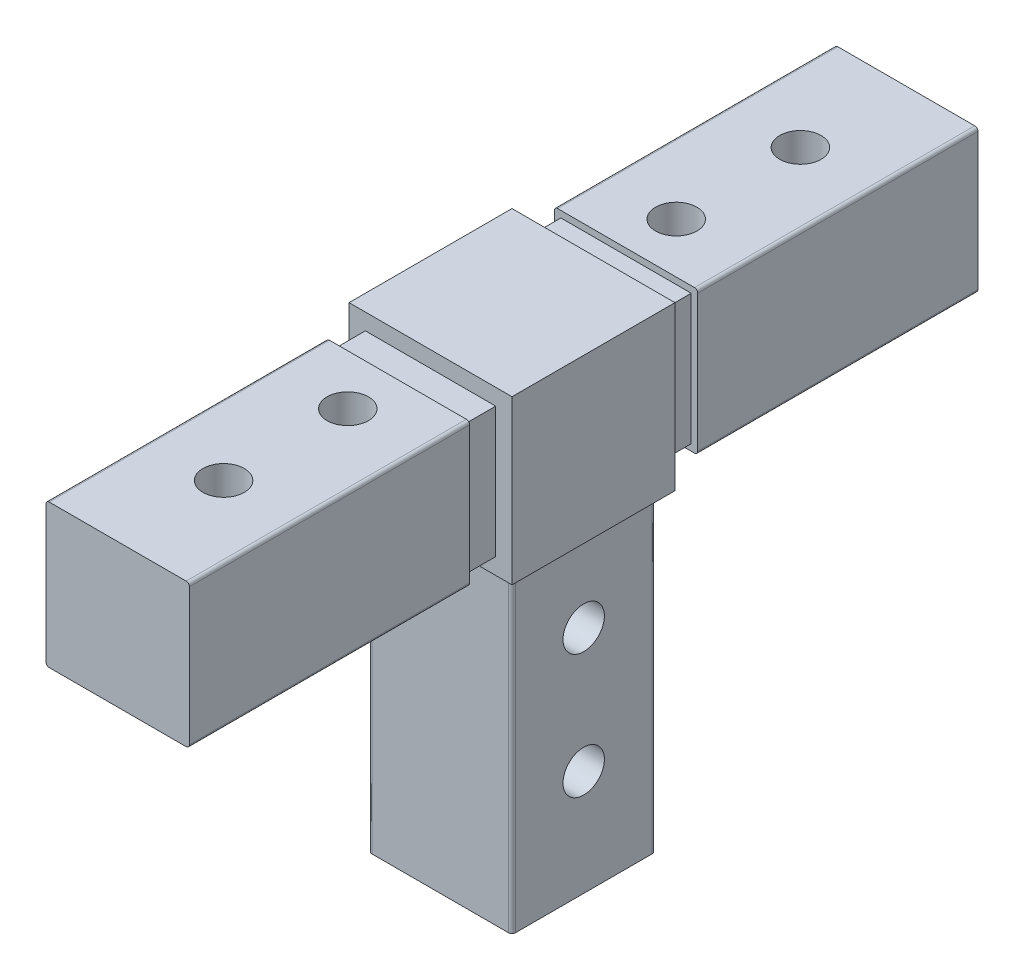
SolidWorks part; units mm, degrees
ref_plane "Front Plane" through (0, 0, 0) normal (0, 0, 1) x (1, 0, 0)
ref_plane "Top Plane" through (0, 0, 0) normal (0, 1, 0) x (1, 0, 0)
ref_plane "Right Plane" through (0, 0, 0) normal (1, 0, 0) x (0, 0, -1)
imported_body "Imported2"
imported_body "Imported3"
sketch "Sketch1" plane through (0, 0, 12.5) normal (0, 0, 1) x (1, 0, 0)
  line L0 (-10, 10) -> (10, 10)
  line L1 (10, 10) -> (10, -10)
  line L2 (10, -10) -> (-10, -10)
  line L3 (-10, -10) -> (-10, 10)
extrude "Boss-Extrude1" add sketch "Sketch1" along normal blind 5
ref_plane "Plane1" through (0, 0, 17.5) normal (0, 0, -1) x (-1, 0, 0)
sketch "Sketch2" plane through (0, 0, 17.5) normal (0, 0, -1) x (-1, 0, 0)
  line L0 (11, -11) -> (11, 11)
  line L1 (11, 11) -> (-11, 11)
  line L2 (-11, 11) -> (-11, -11)
  line L3 (-11, -11) -> (11, -11)
extrude "Boss-Extrude2" add sketch "Sketch2" against normal blind 43
sketch "Sketch3" plane through (0, 10, 0) normal (0, 1, 0) x (-1, 0, 0)
  line L0 (12.5, -12.5) -> (-12.5, -12.5)
  line L1 (-12.5, -12.5) -> (-12.5, 12.5)
  line L2 (-12.5, 12.5) -> (12.5, 12.5)
  line L3 (12.5, 12.5) -> (12.5, -12.5)
extrude "Boss-Extrude3" add sketch "Sketch3" along normal blind 2.5
sketch "Sketch4" plane through (0, -10, 0) normal (0, -1, 0) x (1, 0, 0)
  line L0 (12.5, -12.5) -> (-12.5, -12.5)
  line L1 (-12.5, -12.5) -> (-12.5, 12.5)
  line L2 (-12.5, 12.5) -> (12.5, 12.5)
  line L3 (12.5, 12.5) -> (12.5, -12.5)
extrude "Boss-Extrude4" add sketch "Sketch4" along normal blind 2.5
sketch "Sketch5" plane through (0, 0, -12.5) normal (0, 0, -1) x (-1, 0, 0)
  line L0 (10, -11) -> (-11, -11)
  line L1 (-11, -11) -> (-11, 11)
  line L2 (-11, 11) -> (10, 11)
  line L3 (10, 11) -> (10, -11)
extrude "Boss-Extrude5" add sketch "Sketch5" along normal blind 48
ref_plane "Plane2" through (0, 0, -12.5) normal (0, 0, 1) x (1, 0, 0)
sketch "Sketch6" plane through (0, 0, -12.5) normal (0, 0, 1) x (1, 0, 0)
  line L0 (-10, -10) -> (-10, -11)
  line L1 (-10, -11) -> (11, -11)
  line L2 (11, -11) -> (11, 11)
  line L3 (11, 11) -> (-10, 11)
  line L4 (-10, 11) -> (-10, 10)
  line L5 (-10, 10) -> (10, 10)
  line L6 (10, 10) -> (10, -10)
  line L7 (10, -10) -> (-10, -10)
extrude "Cut-Extrude1" cut sketch "Sketch6" against normal blind 5
sketch "Sketch7" plane through (-10, 0, 0) normal (-1, 0, 0) x (0, 0, 1)
  line L0 (-17.5, 11) -> (-17.5, -11)
  line L1 (-17.5, -11) -> (-60.5, -11)
  line L2 (-60.5, -11) -> (-60.5, 11)
  line L3 (-60.5, 11) -> (-17.5, 11)
extrude "Boss-Extrude6" add sketch "Sketch7" along normal blind 1
sketch "Sketch8" plane through (0, -12.5, 0) normal (0, -1, 0) x (1, 0, 0)
  line L0 (-11, 11) -> (11, 11)
  line L1 (11, 11) -> (11, -11)
  line L2 (11, -11) -> (-11, -11)
  line L3 (-11, -11) -> (-11, 11)
extrude "Boss-Extrude7" add sketch "Sketch8" along normal blind 48
fillet "Fillet1" radius 0.5 12 edges at (-11, -11, -39) (-11, -36.5, -11) (11, -36.5, 11) (11, -11, 39) (11, -11, -39) (11, 11, 39) (-11, -36.5, 11) (-11, 11, 39) (11, -36.5, -11) (-11, 11, -39) (-11, -11, 39) (11, 11, -39)
sketch "Sketch9" plane through (0, 11, 0) normal (0, 1, 0) x (1, 0, 0)
  line L0 (0, -60.5) -> (0, -17.5) construction
  line L1 (-10.5, -60.5) -> (10.5, -60.5) construction
  line L2 (-10.5, -17.5) -> (10.5, -17.5) construction
  line L3 (0, 17.5) -> (0, 60.5) construction
  line L4 (10.5, 17.5) -> (-10.5, 17.5) construction
  line L5 (-10.5, 60.5) -> (10.5, 60.5) construction
  line L6 (-12.5, -12.5) -> (12.5, -12.5) construction
  line L7 (-10, -12.5) -> (10, -12.5) construction
  line L8 (-13.75, 12.5) -> (13.75, 12.5) construction
  circle A0 centre (0, -25.2) radius 3.175
  circle A1 centre (0, -44.25) radius 3.175
  circle A2 centre (0, 25.2) radius 3.175
  circle A3 centre (0, 44.25) radius 3.175
  dimension "D3" = 6.35
  dimension "D4" = 6.35
  dimension "D7" = 6.35
  dimension "D8" = 6.35
  dimension "D1" = 12.7
  dimension "D2" = 31.75
  dimension "D5" = 12.7
  dimension "D6" = 31.75
extrude "Cut-Extrude2" cut sketch "Sketch9" against normal up to surface (22 mm away)
sketch "Sketch10" plane through (11, 0, 0) normal (1, 0, 0) x (0, 0, -1)
  line L0 (0, -12.5) -> (0, -60.5) construction
  line L1 (10.5, -12.5) -> (-10.5, -12.5) construction
  line L2 (10.5, -60.5) -> (-10.5, -60.5) construction
  line L3 (12.5, -12.5) -> (-12.5, -12.5) construction
  circle A0 centre (0, -25.2) radius 3.175
  circle A1 centre (0, -44.25) radius 3.175
  dimension "D3" = 6.35
  dimension "D4" = 6.35
  dimension "D1" = 12.7
  dimension "D2" = 31.75
extrude "Cut-Extrude3" cut sketch "Sketch10" against normal up to surface (22 mm away)
